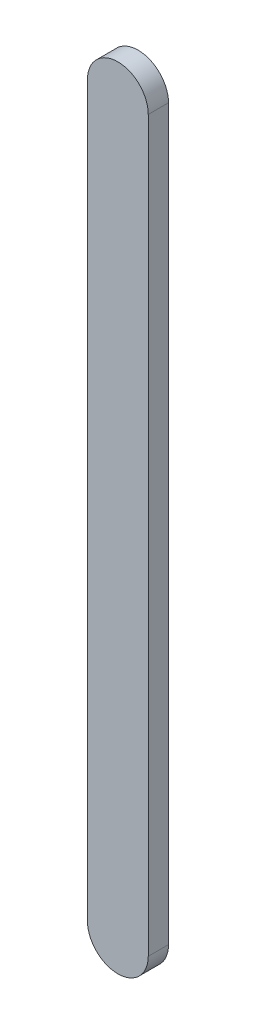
SolidWorks part; units mm, degrees
ref_plane "Front Plane" through (0, 0, 0) normal (0, 0, 1) x (1, 0, 0)
ref_plane "Top Plane" through (0, 0, 0) normal (0, 1, 0) x (1, 0, 0)
ref_plane "Right Plane" through (0, 0, 0) normal (1, 0, 0) x (0, 0, -1)
sketch "Sketch1" plane through (0, 0, 0) normal (0, 0, 1) x (1, 0, 0)
  line L0 (4.7625, 0) -> (4.7625, -114.3)
  line L1 (-4.7625, 0) -> (-4.7625, -114.3)
  arc A0 (4.7625, 0) -> (-4.7625, 0) centre (0, 0) ccw
  arc A1 (-4.7625, -114.3) -> (4.7625, -114.3) centre (0, -114.3) ccw
  dimension "D2" = 114.3
  dimension "D3" = 9.525
extrude "Boss-Extrude1" add sketch "Sketch1" along normal blind 3.175
